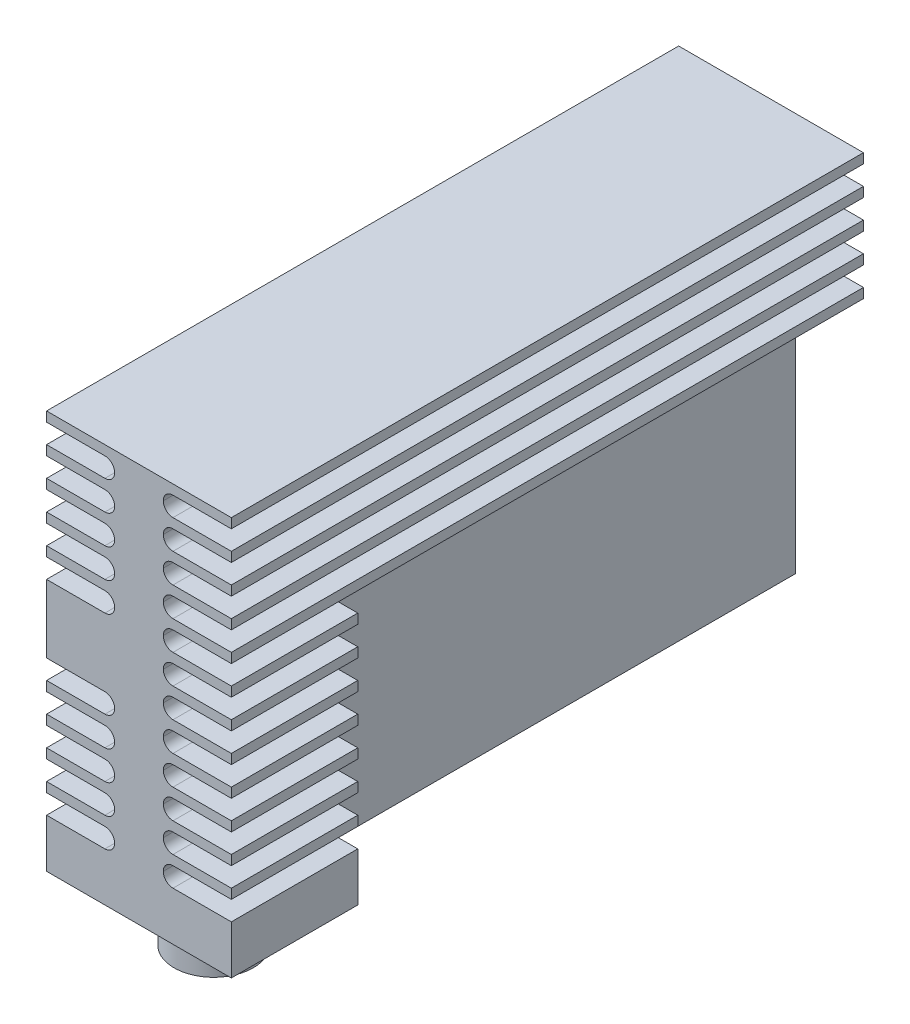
SolidWorks part; units mm, degrees
other "<DIODE HS 1-2A>-<Cut-Extrude4>"
ref_plane "Front Plane" through (0, 0, 0) normal (0, 0, 1) x (1, 0, 0)
ref_plane "Top Plane" through (0, 0, 0) normal (0, 1, 0) x (1, 0, 0)
ref_plane "Right Plane" through (0, 0, 0) normal (1, 0, 0) x (0, 0, -1)
mirrored part "DIODE HS 1-2A_Mirrored" parameters "D1.Boss-Extrude1"=65, "D1.Sketch1"=45, "D2.Sketch1"=19, "D1.Sketch3"=7, "D2.Sketch3"=13, "D3.Sketch3"=2, "D4.Sketch3"=1, "D5.Sketch3"=13, "D1.Cut-Extrude2"=52, "D1.Sketch6"=10, "D1.Sketch7"=0, "D1.Cut-Extrude3"=4, "D2.Cosmetic Thread7"=3, "D2.Cosmetic Thread6"=3, "D2.Cosmetic Thread5"=3, "D2.Cosmetic Thread4"=3, "D2.Cosmetic Thread3"=3, "D2.Cosmetic Thread2"=3, "D2.Cosmetic Thread1"=3, "D1.Fillet1"=1, "Tap Drill Dia..Sketch10"=2.5, "Tap Drill Depth.Sketch10"=8, "Drill Angle.Sketch10"=118, "D2.Cosmetic Thread14"=3, "D2.Cosmetic Thread13"=3, "D2.Cosmetic Thread12"=3, "D2.Cosmetic Thread11"=3, "D2.Cosmetic Thread10"=3, "D2.Cosmetic Thread9"=3, "D2.Cosmetic Thread8"=3, "D1.Cut-Extrude4"=4, "D1.Sketch11"=0, "D2.Sketch11"=8.128
sketch "Sketch1" plane through (31, 0, 0) normal (1, 0, 0) x (0, 0, -1)
  circle A0 centre (-15.15, 26.8729) radius 2.1 construction
  circle A1 centre (-15.15, 26.8729) radius 2.1 construction
hole_wizard "M3x0.5 Tapped Hole1" positions "3DSketch1" profile "Sketch2" tap size "M3x0.5" standard "ANSI Metric"
sketch3d "3DSketch1"
  point P0 (31, 26.8729, 15.15)
sketch "Sketch2" plane through (31, 26.8729, 15.15) normal (0, 1, 0) x (0, 0, -1)
  line L0 (0, 0) -> (0, 8.7511)
  line L1 (0, 8.7511) -> (1.25, 8)
  line L2 (1.25, 8) -> (1.25, 0)
  line L5 (1.25, 0) -> (0, 0)
  line L10 (0, 8.7511) -> (-1.25, 8) construction
  line L11 (0, -6.35) -> (0, 107.95) construction
  dimension "Tap Drill Dia." = 2.5
  dimension "Tap Drill Depth" = 8
  dimension "Drill Angle" = 118
